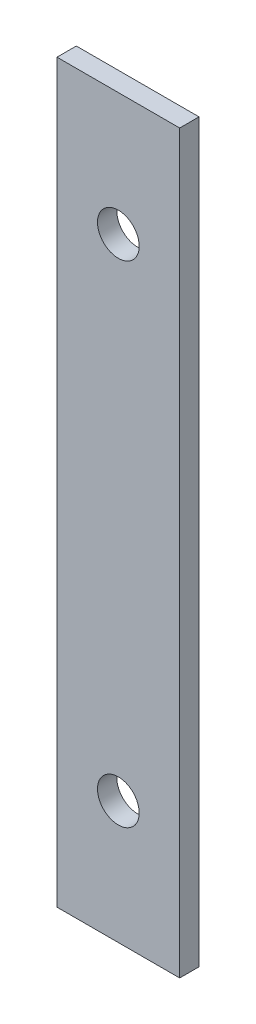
SolidWorks part; units mm, degrees
ref_plane "Front Plane" through (0, 0, 0) normal (0, 0, 1) x (1, 0, 0)
ref_plane "Top Plane" through (0, 0, 0) normal (0, 1, 0) x (1, 0, 0)
ref_plane "Right Plane" through (0, 0, 0) normal (1, 0, 0) x (0, 0, -1)
sketch "Sketch1" plane through (0, 0, 0) normal (0, 0, 1) x (1, 0, 0)
  line L1 (-5, -30) -> (5, -30)
  line L2 (-5, -30) -> (-5, 30)
  line L3 (-5, 30) -> (5, 30)
  line L4 (5, -30) -> (5, 30)
  line L5 (-5, -30) -> (5, 30) construction
  line L6 (-5, 30) -> (5, -30) construction
  point P0 (0, 0)
  dimension "D1" = 60
  dimension "D2" = 10
extrude "Boss-Extrude1" add sketch "Sketch1" along normal blind 1.5748
hole_wizard "M3 Clearance Hole1" positions "Sketch3" profile "Sketch2" hole size "M3" standard "ANSI Metric"
sketch "Sketch3" plane through (0, 0, 1.5748) normal (0, 0, 1) x (1, 0, 0)
  line L0 (0, 0) -> (0, 20) construction
  line L3 (0, 0) -> (-5, 0) construction
  line L4 (-5, 30) -> (-5, -30) construction
  point P0 (0, 20)
  point P17 (0, -20)
  dimension "D1" = 40
sketch "Sketch2" plane through (0, 20, 1.5748) normal (1, 0, 0) x (0, -1, 0)
  line L0 (0, 0) -> (0, 1.5748)
  line L1 (0, 1.5748) -> (1.7, 1.5748)
  line L2 (1.7, 1.5748) -> (1.7, 0)
  line L5 (1.7, 0) -> (0, 0)
  line L11 (0, -6.35) -> (0, 107.95) construction
  dimension "Thru Hole Dia." = 3.4
  dimension "Thru Hole Depth" = 1.5748
